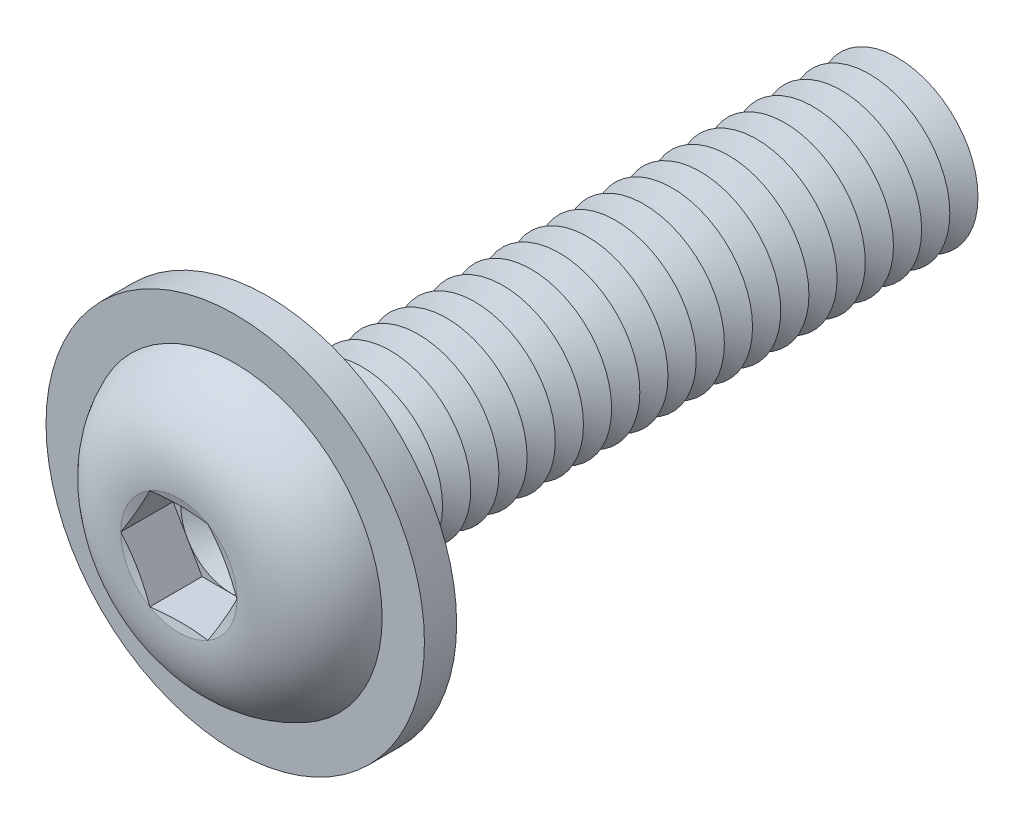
SolidWorks part; units mm, degrees
ref_plane "Front Plane" through (0, 0, 0) normal (0, 0, 1) x (1, 0, 0)
ref_plane "Top Plane" through (0, 0, 0) normal (0, 1, 0) x (1, 0, 0)
ref_plane "Right Plane" through (0, 0, 0) normal (1, 0, 0) x (0, 0, -1)
sketch "Sketch1" plane through (0, 0, 0) normal (1, 0, 0) x (0, 0, -1)
  line L0 (0, 2) -> (0, 3.8)
  line L3 (0, 2) -> (16, 2)
  line L4 (16, 2) -> (16, 0)
  line L5 (16, 0) -> (-2.2, 0) construction
  line L6 (-2.2, 0) -> (16, 0)
  line L7 (-2.2, 1.4434) -> (-2.2, 0.7217) construction
  line L8 (-2.2, 0.7217) -> (-2.2, 0)
  line L9 (-2.2, 1.4434) -> (-2.0066, 0.7217)
  line L10 (-2.0066, 0.7217) -> (-2.2, 0.7217)
  line L11 (16, 0) -> (22.7481, 0) construction
  line L12 (0, 3.8) -> (-2.2, 3.8) construction
  arc A1 (0, 3.8) -> (-2.2, 1.4434) centre (0, 1.5948) ccw
  point P8 (16, 1)
  dimension "D1" = 7.6
  dimension "D2" = 4
  dimension "D3" = 2.2
  dimension "D4" = 2.8868
  dimension "D5" = 16
  dimension "D6" = 15
revolve "Revolve1" add sketch "Sketch1" angle 360 about L5
fillet "Fillet1" radius 0.35 1 edges at (-2, 0, 0)
sketch "Sketch2" plane through (0, 0, 0) normal (1, 0, 0) x (0, 0, -1)
  line L0 (15.65, 2) -> (16.35, 2)
  line L1 (16, 2) -> (0.35, 2) construction
  line L2 (16.35, 2) -> (16, 1.3938)
  line L3 (16, -2) -> (16, 2) construction
  line L4 (16, 1.3938) -> (15.65, 2)
  dimension "D1" = 0.7
revolve "Cut-Revolve1" cut sketch "Sketch2" angle 360 about axis through (0, 0, -16) along (0, 0, -1)
pattern_linear "LPattern1" count 22 spacing 0.7 along (0, 0, 1) of "Cut-Revolve1"
sketch "Sketch3" plane through (0, 0, 2.2) normal (0, 0, 1) x (1, 0, 0)
  line L7 (0.7217, 1.25) -> (-0.7217, 1.25)
  line L8 (-0.7217, 1.25) -> (-1.4434, 0)
  line L9 (-1.4434, 0) -> (-0.7217, -1.25)
  line L10 (-0.7217, -1.25) -> (0.7217, -1.25)
  line L11 (0.7217, -1.25) -> (1.4434, 0)
  line L12 (1.4434, 0) -> (0.7217, 1.25)
  circle A0 centre (0, 0) radius 1.25 construction
  circle A3 centre (0, 0) radius 1.4434 construction
extrude "Cut-Extrude1" cut sketch "Sketch3" against normal blind 1.3
sketch "Sketch4" plane through (0, 0, 0.9) normal (0, 0, 1) x (1, 0, 0)
  line L1 (0.7217, 1.25) -> (-0.7217, 1.25) construction
  circle A0 centre (0, 0) radius 1.25
extrude "Cut-Extrude2" cut sketch "Sketch4" against normal through all draft 60
sketch "Sketch5" plane through (0, 0, 0) normal (0, 0, -1) x (-1, 0, 0)
  circle A0 centre (0, 0) radius 4.7
  circle A1 centre (0, 0) radius 2.35
  circle A2 centre (0, 0) radius 2.35 construction
  dimension "D1" = 9.4
extrude "Boss-Extrude1" add sketch "Sketch5" against normal blind 0.8
